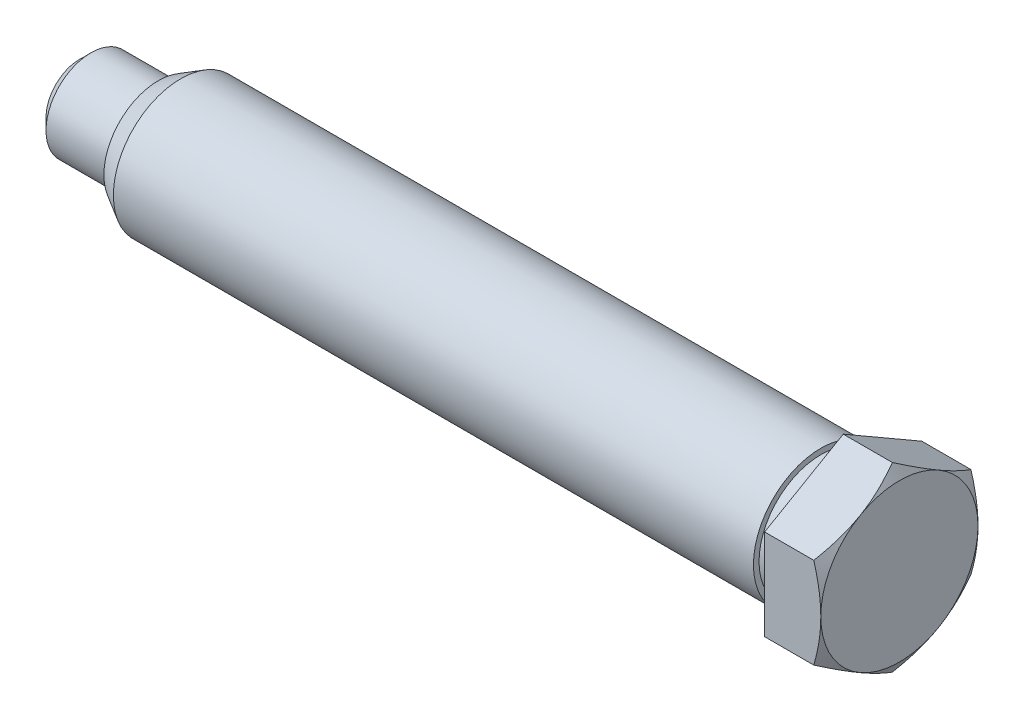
SolidWorks part; units mm, degrees
ref_plane "Plan1" through (0, 0, 0) normal (0, 0, 1) x (1, 0, 0)
ref_plane "Plan2" through (0, 0, 0) normal (0, 1, 0) x (1, 0, 0)
ref_plane "Plan3" through (0, 0, 0) normal (1, 0, 0) x (0, 0, -1)
sketch "Esquisse1" plane through (0, 0, 0) normal (0, 0, 1) x (1, 0, 0)
  line L0 (-100, 0) -> (100, 0) construction
  line L1 (-80, 0) -> (-80, 4)
  line L2 (-80, 4) -> (-73, 4)
  line L3 (-73, 4) -> (-73, 4.8453)
  line L4 (-73, 4.8453) -> (-71, 6)
  line L5 (-71, 6) -> (-14, 6)
  line L6 (-14, 6) -> (-14, 5.5)
  line L7 (-14, 5.5) -> (-12, 5.5)
  line L8 (-12, 5.5) -> (-12, 9)
  line L9 (-12, 9) -> (-8.1547, 9)
  line L10 (-7, 7) -> (-7, 0)
  line L11 (-80, 0) -> (-7, 0)
  line L12 (-7, 7) -> (-8.1547, 9)
  dimension "D1" = 7
  dimension "D2" = 4
  dimension "D3" = 6
  dimension "D4" = 150
  dimension "D5" = 2
  dimension "D6" = 2
  dimension "D7" = 61
  dimension "D8" = 5.5
  dimension "D9" = 7
  dimension "D10" = 9
  dimension "D11" = 30
  dimension "D12" = 5
revolve "Base-Révolution" add sketch "Esquisse1" angle 360 about L0
chamfer "Chanfrein1" distance 1 angle 45
sketch "Esquisse2" plane through (-7, 0, 0) normal (1, 0, 0) x (0, 0, -1)
  line L1 (-7, 10) -> (7, 10)
  line L2 (-7, 10) -> (-7, -10)
  line L3 (-7, -10) -> (7, -10)
  line L4 (7, 10) -> (7, -10)
  dimension "D1" = 7
  dimension "D2" = 7
  dimension "D3" = 10
  dimension "D4" = 10
extrude "Enlèv. mat.-Extru.1" cut sketch "Esquisse2" against normal through all flip side to cut
pattern_circular "Répétition circulaire2" count 3 every 60
